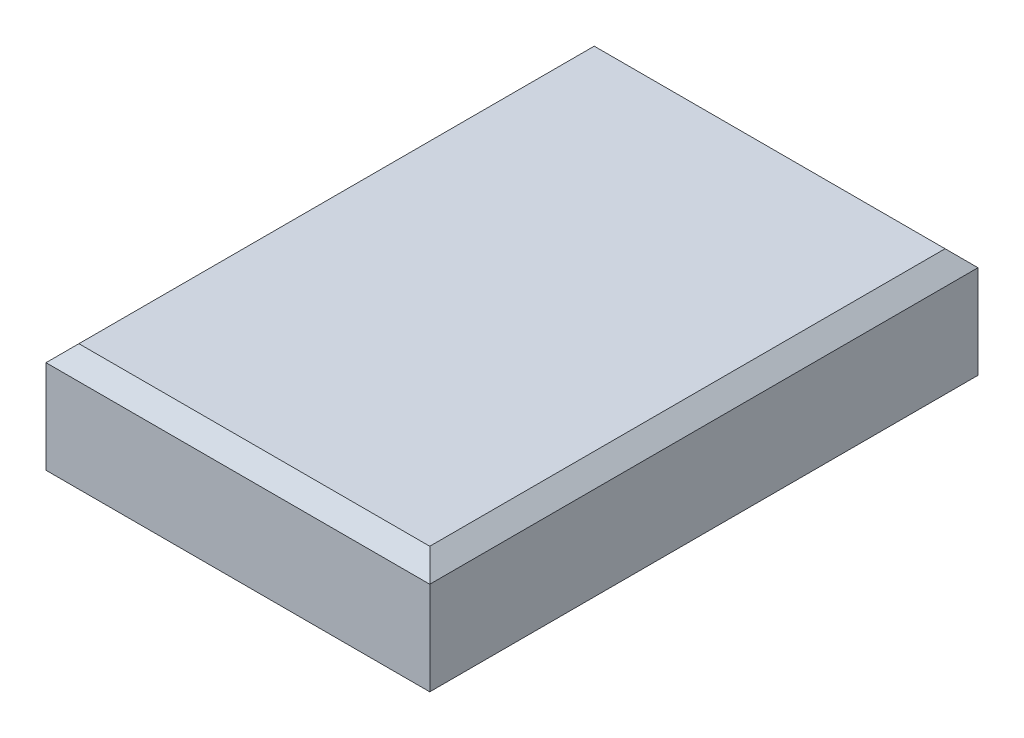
SolidWorks part; units mm, degrees
ref_plane "Front Plane" through (0, 0, 0) normal (0, 0, 1) x (1, 0, 0)
ref_plane "Top Plane" through (0, 0, 0) normal (0, 1, 0) x (1, 0, 0)
ref_plane "Right Plane" through (0, 0, 0) normal (1, 0, 0) x (0, 0, -1)
sketch "Sketch1" plane through (0, 0, 0) normal (0, 1, 0) x (1, 0, 0)
  line L1 (-35, -50) -> (35, -50)
  line L2 (-35, -50) -> (-35, 50)
  line L3 (-35, 50) -> (35, 50)
  line L4 (35, -50) -> (35, 50)
  line L5 (-35, -50) -> (35, 50) construction
  line L6 (-35, 50) -> (35, -50) construction
  point P0 (0, 0)
  dimension "D1" = 70
  dimension "D2" = 100
extrude "Boss-Extrude1" add sketch "Sketch1" along normal blind 20
chamfer "Chamfer1" distance 3 angle 45 4 edges at (0, 20, 50) (-35, 20, 0) (0, 20, -50) (35, 20, 0)
